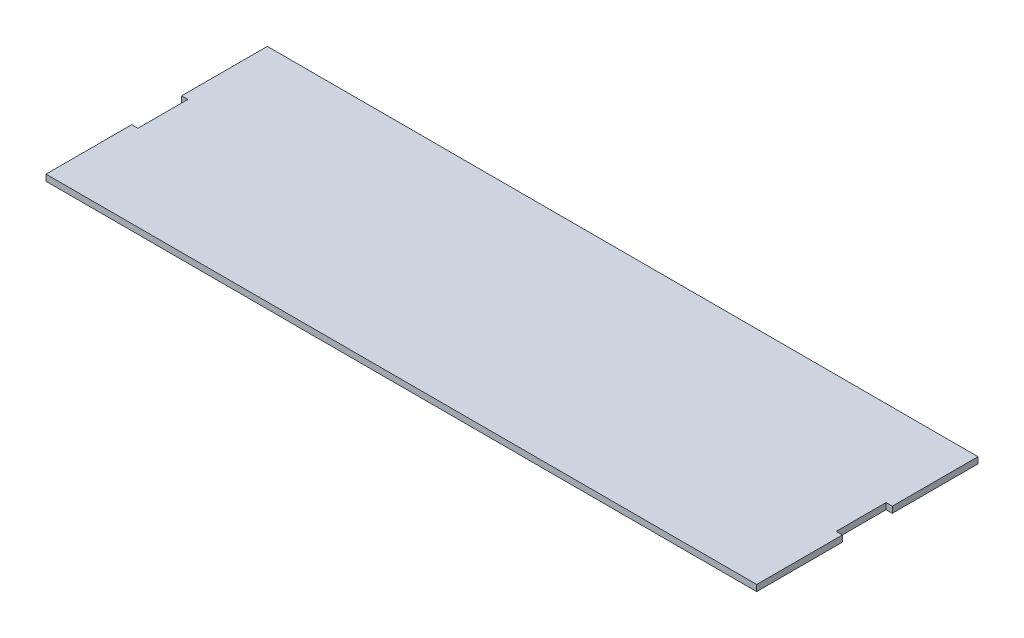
SolidWorks part; units mm, degrees
ref_plane "Plan de face" through (0, 0, 0) normal (0, 0, 1) x (1, 0, 0)
ref_plane "Plan de dessus" through (0, 0, 0) normal (0, 1, 0) x (1, 0, 0)
ref_plane "Plan de droite" through (0, 0, 0) normal (1, 0, 0) x (0, 0, -1)
sketch "Esquisse1" plane through (0, 0, 0) normal (0, 1, 0) x (1, 0, 0)
  line L1 (-114, 35.5) -> (114, 35.5)
  line L2 (-114, 35.5) -> (-114, -35.5)
  line L3 (-114, -35.5) -> (114, -35.5)
  line L4 (114, 35.5) -> (114, -35.5)
  dimension "D1" = 114
  dimension "D2" = 228
  dimension "D3" = 35.5
  dimension "D4" = 71
extrude "Extrusion1" add sketch "Esquisse1" along normal blind 2
sketch "Esquisse2" plane through (0, 2, 0) normal (0, 1, 0) x (-1, 0, 0)
  line L0 (-114, 35.5) -> (-114, -35.5) construction
  line L1 (-123.024, -8) -> (-112, -8)
  line L2 (-123.024, -8) -> (-123.024, 8)
  line L3 (-123.024, 8) -> (-112, 8)
  line L4 (-112, -8) -> (-112, 8)
  dimension "D1" = 2
  dimension "D2" = 16
  dimension "D3" = 27.5
  dimension "D4" = 11.024
extrude "Enlèv. mat.-Extru.1" cut sketch "Esquisse2" against normal through all
sketch "Esquisse3" plane through (0, 2, 0) normal (0, 1, 0) x (-1, 0, 0)
  line L0 (114, -35.5) -> (114, 35.5) construction
  line L1 (112, -8) -> (123.9826, -8)
  line L2 (112, -8) -> (112, 8)
  line L3 (112, 8) -> (123.9826, 8)
  line L4 (123.9826, -8) -> (123.9826, 8)
  line L5 (114, 35.5) -> (-114, 35.5) construction
  dimension "D1" = 16
  dimension "D2" = 2
  dimension "D3" = 27.5
  dimension "D4" = 11.9826
extrude "Enlèv. mat.-Extru.2" cut sketch "Esquisse3" against normal through all
